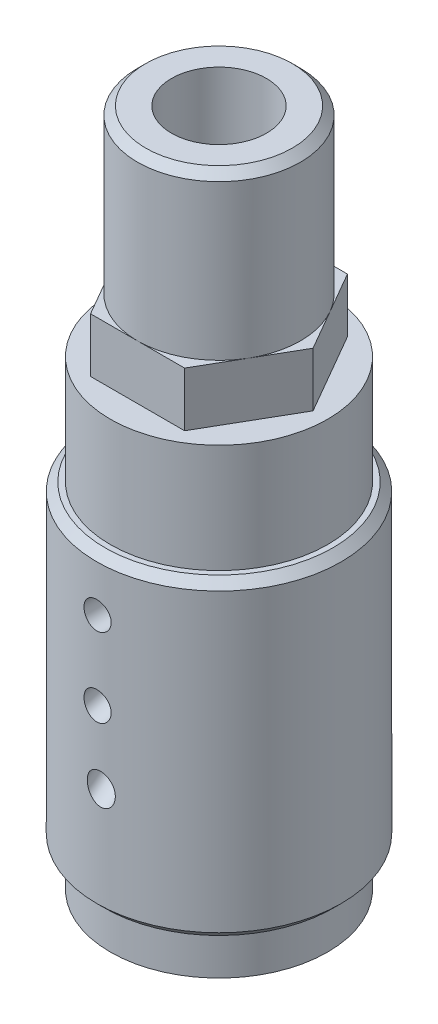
SolidWorks part; units mm, degrees
ref_plane "Ebene vorne" through (0, 0, 0) normal (0, 0, 1) x (1, 0, 0)
ref_plane "Ebene oben" through (0, 0, 0) normal (0, 1, 0) x (1, 0, 0)
ref_plane "Ebene rechts" through (0, 0, 0) normal (1, 0, 0) x (0, 0, -1)
sketch "Skizze1" plane through (0, 0, 0) normal (0, 0, 1) x (1, 0, 0)
  line L0 (0, 0) -> (0, 61.3251) construction
  line L1 (0, 25) -> (-3, 25)
  line L2 (-3, 25) -> (-3, 19)
  line L3 (-3, 19) -> (-3.5, 19)
  line L4 (-3.5, 19) -> (-3.5, 17)
  line L5 (-3.5, 17) -> (-4, 17)
  line L6 (-4, 17) -> (-4, 13)
  line L7 (-4, 13) -> (-4.5, 13)
  line L8 (-4.5, 13) -> (-4.5, 1.5)
  line L9 (-4.5, 1.5) -> (-4, 1.5)
  line L10 (-4, 1.5) -> (-4, 0)
  line L11 (-4, 0) -> (0, 0)
  line L12 (0, 0) -> (0, 25)
  dimension "D1" = 6
  dimension "D2" = 7
  dimension "D3" = 8
  dimension "D4" = 9
  dimension "D5" = 6
  dimension "D6" = 12
  dimension "D7" = 11.5
  dimension "D8" = 25
  dimension "D9" = 2
revolve "Rotation1" add sketch "Skizze1" angle 360 about L0
sketch "Skizze2" plane through (0, 25, 0) normal (0, 1, 0) x (1, 0, 0)
  circle A0 centre (0, 0) radius 1.75
  dimension "D1" = 3.5
extrude "Linear austragen1" cut sketch "Skizze2" against normal blind 20
sketch "Skizze3" plane through (0, 19, 0) normal (0, 1, 0) x (1, 0, 0)
  line L0 (0, 0) -> (-3.4641, 0) construction
  line L1 (-3.4641, 0) -> (-1.7321, -3)
  line L2 (-1.7321, -3) -> (1.7321, -3)
  line L3 (1.7321, -3) -> (3.4641, 0)
  line L4 (3.4641, 0) -> (1.7321, 3)
  line L5 (1.7321, 3) -> (-1.7321, 3)
  line L6 (-1.7321, 3) -> (-3.4641, 0)
  circle A0 centre (0, 0) radius 3 construction
  circle A1 centre (0, 0) radius 4
  dimension "D2" = 8
  dimension "D1" = 6
extrude "Linear austragen2" cut sketch "Skizze3" against normal up to surface (2 mm away)
sketch "Skizze4" plane through (0, 0, 0) normal (0, -1, 0) x (1, 0, 0)
  line L1 (-0.5, -3) -> (0.5, -3)
  line L2 (-0.5, -3) -> (-0.5, 3)
  line L3 (-0.5, 3) -> (0.5, 3)
  line L4 (0.5, -3) -> (0.5, 3)
  line L5 (-0.5, -3) -> (0.5, 3) construction
  line L6 (-0.5, 3) -> (0.5, -3) construction
  point P0 (0, 0)
  dimension "D1" = 1
  dimension "D2" = 6
extrude "Linear austragen3" cut sketch "Skizze4" against normal blind 5
sketch "Skizze5" plane through (0, 0, 0) normal (0, 0, 1) x (1, 0, 0)
  circle A0 centre (0, 11) radius 0.5
  dimension "D1" = 1
  dimension "D2" = 11
extrude "Linear austragen5" cut sketch "Skizze5" along normal up to surface (4.4721 mm away)
ref_plane "Ebene1" through (0, 1.1388, -4.25) normal (0, -0.2588, 0.9659) x (1, 0, 0)
sketch "Skizze6" plane through (0, 1.1388, -4.25) normal (0, -0.2588, 0.9659) x (1, 0, 0)
  circle A0 centre (0, 9) radius 0.5
  dimension "D1" = 1
  dimension "D2" = 9
extrude "Linear austragen6" cut sketch "Skizze6" along normal up to surface (5.7811 mm away) from offset 1
ref_plane "Ebene2" through (-0.9477, 4.2798, -7.8044) normal (0.1059, -0.4781, 0.8719) x (0.9944, 0.0509, -0.0928)
sketch "Skizze7" plane through (-0.9477, 4.2798, -7.8044) normal (0.1059, -0.4781, 0.8719) x (0.9944, 0.0509, -0.0928)
  circle A0 centre (0, 7) radius 0.5
  dimension "D1" = 1
  dimension "D2" = 7
extrude "Linear austragen7" cut sketch "Skizze7" along normal up to surface (6.5242 mm away) from offset 4
chamfer "Fase1" distance 0.3 angle 45 3 edges at (4.5, 1.5, 0) (4.5, 13, 0) (3, 25, 0)
